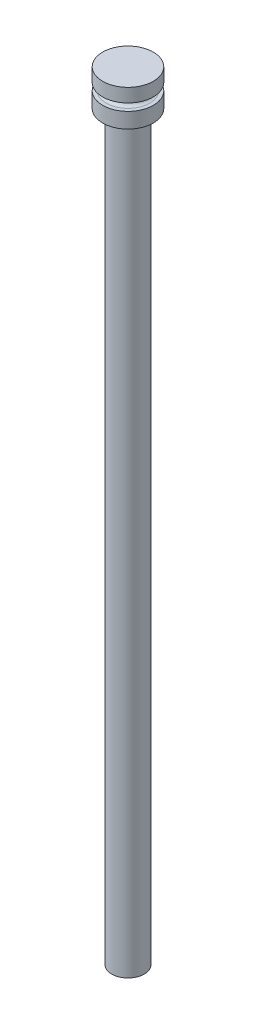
SolidWorks part; units mm, degrees
ref_plane "Front Plane" through (0, 0, 0) normal (0, 0, 1) x (1, 0, 0)
ref_plane "Top Plane" through (0, 0, 0) normal (0, 1, 0) x (1, 0, 0)
ref_plane "Right Plane" through (0, 0, 0) normal (1, 0, 0) x (0, 0, -1)
sketch "Sketch1" plane through (0, 0, 0) normal (0, 0, 1) x (1, 0, 0)
  line L1 (0, 0) -> (14, 0)
  line L2 (0, 0) -> (0, -7.5)
  line L3 (0, -20) -> (5, -20)
  line L6 (5, -20) -> (5, -430)
  line L7 (5, -430) -> (14, -430)
  line L9 (14, 0) -> (14, -430) construction
  line L10 (0, -7.5) -> (2, -7.5)
  line L11 (2, -11.5) -> (0, -11.5)
  line L12 (4, -9.5) -> (14, -9.5) construction
  line L15 (0, -11.5) -> (0, -20)
  line L17 (14, 0) -> (14, -430)
  arc A0 (2, -7.5) -> (2, -11.5) centre (2, -9.5) cw
  dimension "D5" = 2
  dimension "D3" = 20
  dimension "D4" = 4
  dimension "D6" = 430
revolve "Revolve5" add sketch "Sketch1" angle 360 about L17
